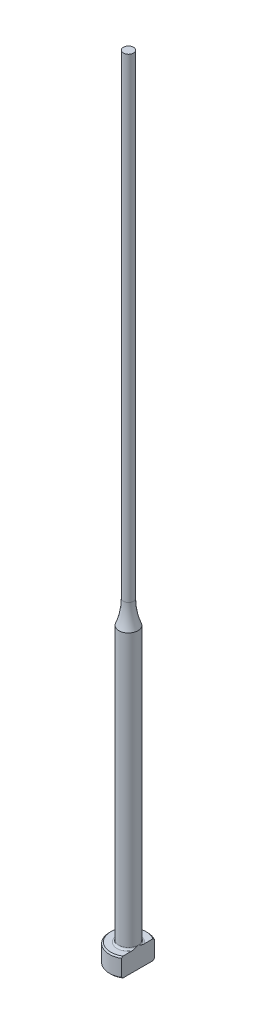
SolidWorks part; units mm, degrees
ref_plane "Front Plane" through (0, 0, 0) normal (0, 0, 1) x (1, 0, 0)
ref_plane "Top Plane" through (0, 0, 0) normal (0, 1, 0) x (1, 0, 0)
ref_plane "Right Plane" through (0, 0, 0) normal (1, 0, 0) x (0, 0, -1)
sketch "Sketch1" plane through (0, 0, 0) normal (0, 0, 1) x (1, 0, 0)
  line L0 (0, 259.9588) -> (0, -15.1925) construction
  line L1 (0, 0) -> (-3, 0)
  line L2 (-3, 0) -> (-3, 3)
  line L3 (-3, 3) -> (-1.5, 3)
  line L4 (-0.8, 50) -> (-0.8, 125)
  line L5 (-0.8, 125) -> (0, 125)
  line L6 (0, 125) -> (0, 0)
  line L7 (-1.5, 3) -> (-1.5, 46.3244)
  arc A0 (-1.5, 46.3244) -> (-0.8, 50) centre (-10.8, 50) ccw
  point P13 (-1.5, 0)
  dimension "D1" = 10
  dimension "L" = 125
  dimension "H" = 6
  dimension "T" = 3
  dimension "D" = 1.6
  dimension "B" = 3
  dimension "S" = 50
revolve "Revolve1" add sketch "Sketch1" angle 360 about L0
chamfer "Chamfer1" distance 0.2 angle 45 2 edges at (0, 3, 3) (0, 0, 3)
fillet "Fillet1" radius 0.3 1 edges at (0, 3, 1.5)
sketch "Sketch2" plane through (0, 0, 0) normal (0, 1, 0) x (1, 0, 0)
  line L0 (1.5, 2.5981) -> (1.5, -2.5981)
  circle A0 centre (0, 0) radius 3 construction
  arc A1 (1.5, -2.5981) -> (1.5, 2.5981) centre (0, 0) ccw
  circle A2 centre (0, 0) radius 1.5 construction
extrude "KEY" cut sketch "Sketch2" along normal through all
